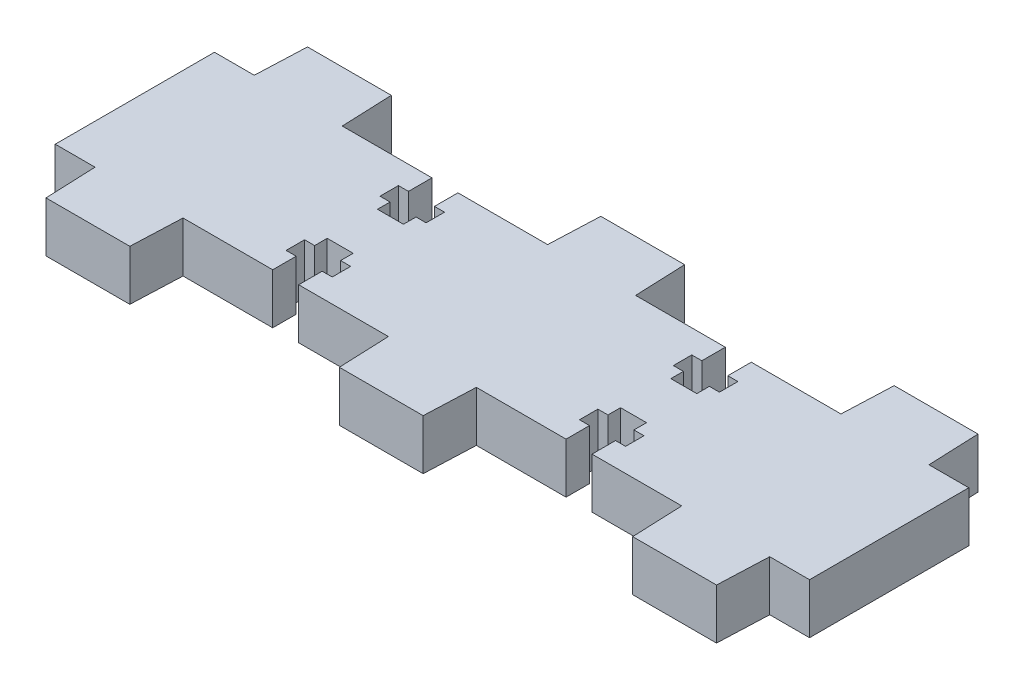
SolidWorks part; units mm, degrees
ref_plane "Спереди" through (0, 0, 0) normal (0, 0, 1) x (1, 0, 0)
ref_plane "Сверху" through (0, 0, 0) normal (0, 1, 0) x (1, 0, 0)
ref_plane "Справа" through (0, 0, 0) normal (1, 0, 0) x (0, 0, -1)
sketch "Эскиз1" plane through (0, 0, 0) normal (0, 1, 0) x (1, 0, 0)
  line L0 (0, 32.1169) -> (0, 0) construction
  line L1 (0, 0) -> (77.3768, 0) construction
  line L2 (0, 15.6) -> (5, 15.6)
  line L3 (5, 15.6) -> (5.25, 9.5)
  line L4 (5.25, 9.5) -> (15.95, 9.5)
  line L5 (15.95, 9.5) -> (15.95, 6.7)
  line L6 (15.95, 6.7) -> (14.75, 6.7)
  line L7 (14.75, 6.7) -> (14.75, 4.5)
  line L8 (14.75, 4.5) -> (15.95, 4.5)
  line L9 (15.95, 4.5) -> (15.95, 3)
  line L10 (15.95, 3) -> (19.05, 3)
  line L11 (19.05, 4.5) -> (19.05, 3)
  line L12 (20.25, 4.5) -> (19.05, 4.5)
  line L13 (20.25, 6.7) -> (20.25, 4.5)
  line L14 (19.05, 6.7) -> (20.25, 6.7)
  line L15 (19.05, 9.5) -> (19.05, 6.7)
  line L16 (29.75, 9.5) -> (19.05, 9.5)
  line L17 (29.75, 9.5) -> (30, 15.6)
  line L18 (30, 15.6) -> (40, 15.6)
  line L19 (40, 15.6) -> (40.25, 9.5)
  line L20 (40.25, 9.5) -> (45, 9.5)
  line L21 (45, 9.5) -> (45, 0)
  line L22 (17.5, 3) -> (17.5, 10.6909) construction
  line L23 (0, 15.6) -> (0, 0)
  line L24 (0, 0) -> (45, 0)
  dimension "D1" = 90
  dimension "D2" = 10
  dimension "D3" = 10.5
  dimension "D4" = 6.1
  dimension "D5" = 10
  dimension "D6" = 3.1
  dimension "D7" = 19
  dimension "D8" = 10.5
  dimension "D9" = 17.5
  dimension "D10" = 5.5
  dimension "D11" = 2.2
  dimension "D12" = 6.5
  dimension "D13" = 1.5
  dimension "D14" = 35
extrude "Бобышка-Вытянуть1" add sketch "Эскиз1" along normal blind 6
mirror "Зеркальное отражение1" about plane through (0, 6, -15.6) normal (1, 0, 0)
mirror "Зеркальное отражение2" about plane through (0, 6, 0) normal (0, 0, -1)
